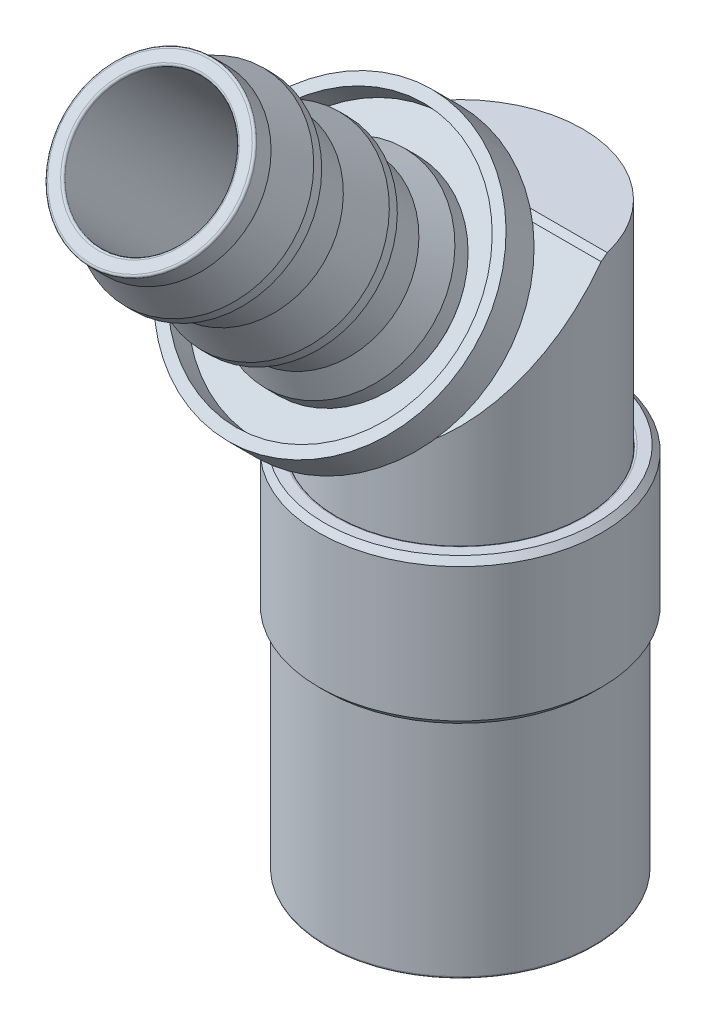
SolidWorks part; units mm, degrees
other "BODY_"
ref_plane "Front Plane" through (0, 0, 0) normal (0, 0, 1) x (1, 0, 0)
ref_plane "Top Plane" through (0, 0, 0) normal (0, 1, 0) x (1, 0, 0)
ref_plane "Right Plane" through (0, 0, 0) normal (1, 0, 0) x (0, 0, -1)
imported_body "SLEEVE"
imported_body "BARB"
imported_body "PL-BARB"
imported_body "SC200S"
imported_body "BODY"
sketch "Sketch2" plane through (0, 0, 0) normal (0, -1, 0) x (1, 0, 0)
  circle A0 centre (0, 0) radius 7.9375
  circle A5 centre (0, 0) radius 10.033
  dimension "D1" = 15.875
extrude "Boss-Extrude1" add sketch "Sketch2" against normal up to surface (14.9733 mm away)
sketch "Sketch1" plane through (0, 0, 0) normal (0, -1, 0) x (1, 0, 0)
  line L1 (0, 11.1452) -> (-9.652, 5.5726)
  line L2 (-9.652, 5.5726) -> (-9.652, -5.5726)
  line L3 (-9.652, -5.5726) -> (0, -11.1452)
  line L4 (0, -11.1452) -> (9.652, -5.5726)
  line L5 (9.652, -5.5726) -> (9.652, 5.5726)
  line L6 (9.652, 5.5726) -> (0, 11.1452)
  circle A0 centre (0, 0) radius 9.652 construction
  dimension "D1" = 19.304
extrude "Cut-Extrude2" cut sketch "Sketch1" against normal up to surface (18.181 mm away)
